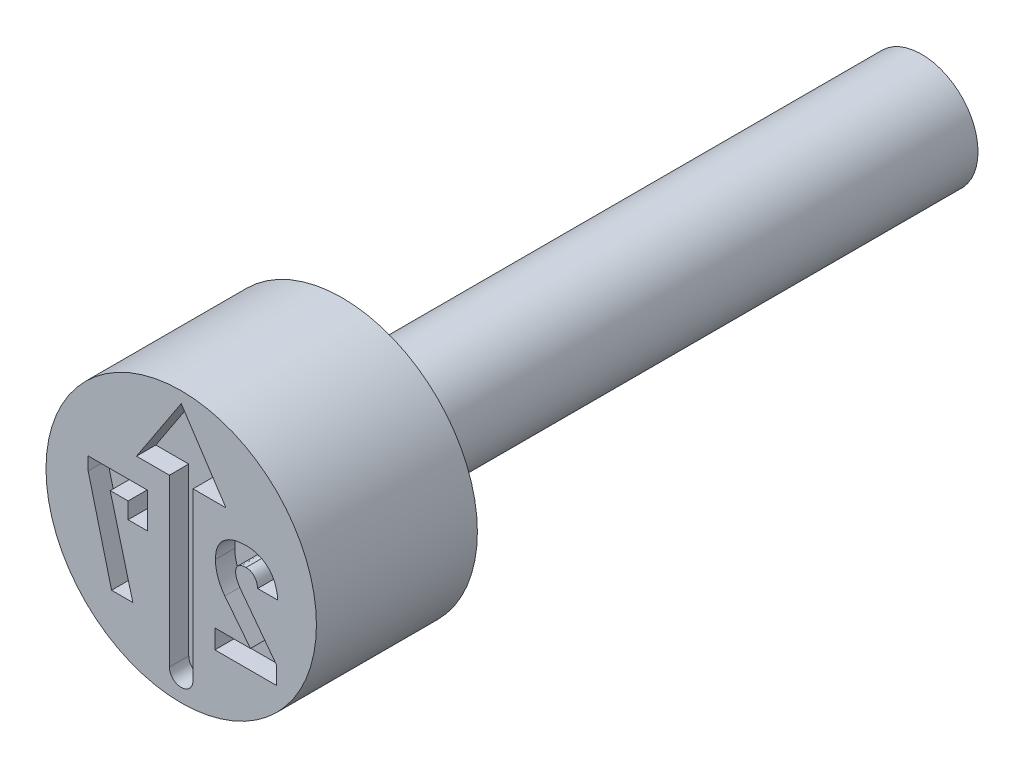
SolidWorks part; units mm, degrees
ref_plane "Front Plane" through (0, 0, 0) normal (0, 0, 1) x (1, 0, 0)
ref_plane "Top Plane" through (0, 0, 0) normal (0, 1, 0) x (1, 0, 0)
ref_plane "Right Plane" through (0, 0, 0) normal (1, 0, 0) x (0, 0, -1)
sketch "Sketch2" plane through (0, 0, 0) normal (1, 0, 0) x (0, 0, -1)
  line L0 (0.4039, 0) -> (50000.4039, 0) construction
  line L6 (0, 4.2) -> (0, 0)
  line L7 (5, 4.2) -> (0, 4.2)
  line L8 (5, 1.75) -> (5, 4.2)
  line L9 (23, 1.75) -> (5, 1.75)
  line L10 (23, 0) -> (23, 1.75)
  line L11 (0, 0) -> (23, 0)
  dimension "D1" = 8.4
  dimension "D2" = 3.5
  dimension "D3" = 23
  dimension "D4" = 5
revolve "Revolve1" add sketch "Sketch2" angle 360 about L0
sketch "Sketch3" plane through (0, 0, 0) normal (0, 0, 1) x (1, 0, 0)
  line L0 (0, 0) -> (0, 192375) construction
  line L1 (0.3664, 1.7436) -> (0.3664, -3.4169)
  line L2 (1.3888, 1.7436) -> (0.3664, 1.7436)
  line L3 (0, 3.8516) -> (1.3888, 1.7436)
  line L15 (0, 3.8516) -> (-1.3888, 1.7436)
  line L16 (-1.3888, 1.7436) -> (-0.3664, 1.7436)
  line L17 (-0.3664, 1.7436) -> (-0.3664, -3.4169)
  arc A2 (-0.3664, -3.4169) -> (0.3664, -3.4169) centre (0, -3.4169) ccw
extrude "Cut-Extrude4" cut sketch "Sketch3" against normal blind 0.6
sketch "Sketch4" plane through (0, 0, 0) normal (0, 0, 1) x (1, 0, 0)
  text T0 "2  7" font "Bahnschrift" height 3.25
  dimension "D1" = 2.25
  dimension "D2" = 3.2
extrude "Cut-Extrude5" cut sketch "Sketch4" against normal blind 0.6
